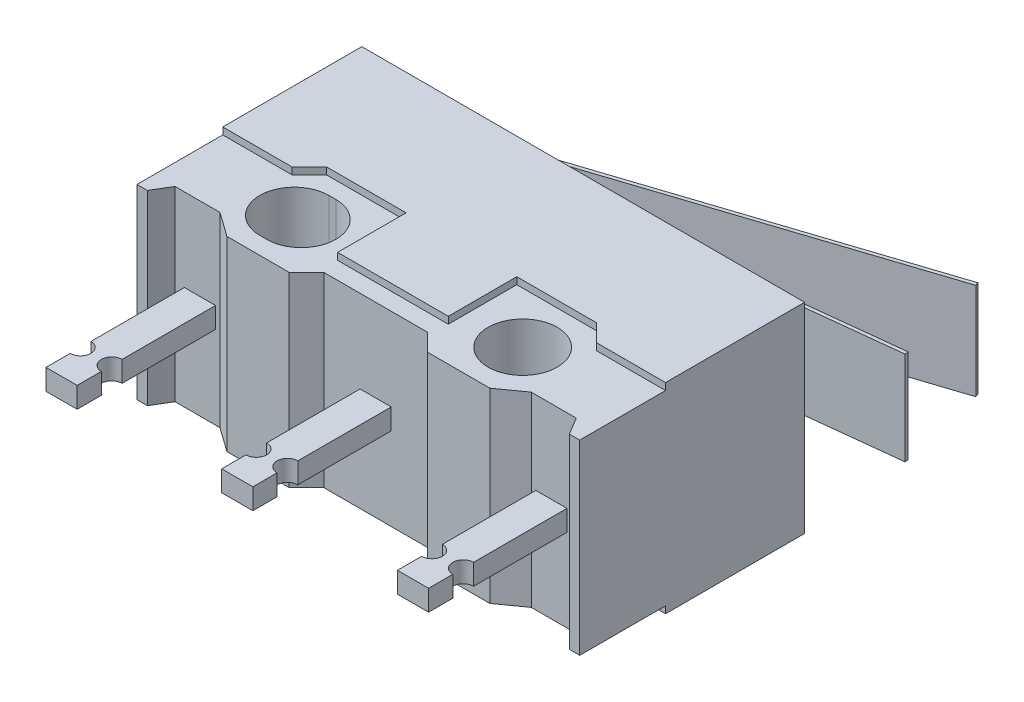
SolidWorks part; units mm, degrees
ref_plane "DESSUS" through (0, 0, 0) normal (0, 0, 1) x (1, 0, 0)
ref_plane "FACE" through (0, 0, 0) normal (0, 1, 0) x (1, 0, 0)
ref_plane "COTE" through (0, 0, 0) normal (1, 0, 0) x (0, 0, -1)
sketch "Esquisse1" plane through (0, 0, 0) normal (0, 1, 0) x (1, 0, 0)
  line L0 (-6.4, 3.25) -> (6.4, -3.25) construction
  line L1 (-6.4, 3.25) -> (6.4, 3.25)
  line L2 (-6.4, 3.25) -> (-6.4, -3.25)
  line L3 (-6.4, -3.25) -> (-6.1, -3.25)
  line L4 (6.4, 3.25) -> (6.4, -3.25)
  line L5 (-3.35, -0.75) -> (-3.15, -0.75)
  line L6 (-3.35, -2.75) -> (-3.15, -2.75)
  line L7 (-3.25, -0.75) -> (-3.25, -2.75) construction
  line L8 (-6.1, -3.25) -> (-5.8, -2.75)
  line L9 (-5.8, -2.75) -> (-4.5, -2.75)
  line L10 (-4.5, -2.75) -> (-3.8, -3.25)
  line L11 (-3.8, -3.25) -> (-2, -3.25)
  line L12 (-2, -3.25) -> (-1.5, -2.75)
  line L13 (-1.5, -2.75) -> (1.5, -2.75)
  line L14 (0, 4.8) -> (0, -4.8) construction
  line L15 (6.4, -3.25) -> (6.1, -3.25)
  line L16 (2, -3.25) -> (1.5, -2.75)
  line L17 (3.8, -3.25) -> (2, -3.25)
  line L18 (4.5, -2.75) -> (3.8, -3.25)
  line L19 (5.8, -2.75) -> (4.5, -2.75)
  line L20 (6.1, -3.25) -> (5.8, -2.75)
  arc A0 (-3.35, -0.75) -> (-3.35, -2.75) centre (-3.35, -1.75) ccw
  circle A1 centre (3.25, -1.75) radius 1
  arc A2 (-3.15, -2.75) -> (-3.15, -0.75) centre (-3.15, -1.75) ccw
  point P25 (0, -2.74)
  dimension "D2" = 2
  dimension "D3" = 2.2
  dimension "D5" = 1.5
  dimension "D7" = 3.25
  dimension "D1" = 12.8
  dimension "D4" = 5
  dimension "D6" = 6.5
  dimension "D8" = 0.3
  dimension "D10" = 0.3
  dimension "D11" = 1.3
  dimension "D12" = 0.7
  dimension "D13" = 0.5
  dimension "D14" = 0.5
  dimension "D15" = 1.8
extrude "Extrusion1" add sketch "Esquisse1" along normal mid plane 5.79
sketch "Esquisse2" plane through (0, 2.895, 0) normal (0, 1, 0) x (-1, 0, 0)
  line L0 (6.4, 0.77) -> (4.4, 0.77)
  line L1 (4.4, 0.77) -> (3.9, 0.27)
  line L2 (3.9, 0.27) -> (1.6, 0.27)
  line L3 (1.6, 0.27) -> (1.6, 2.25)
  line L4 (1.6, 2.25) -> (-1.6, 2.25)
  line L5 (6.4, 0.77) -> (6.4, 3.25)
  line L6 (0, -4.1) -> (0, 4.7) construction
  line L7 (-6.1, 3.25) -> (-6.4, 3.25) construction
  line L8 (-5.8, 2.75) -> (-6.1, 3.25) construction
  line L9 (-4.5, 2.75) -> (-5.8, 2.75) construction
  line L10 (-3.8, 3.25) -> (-4.5, 2.75) construction
  line L11 (-2, 3.25) -> (-3.8, 3.25) construction
  line L12 (-1.5, 2.75) -> (-2, 3.25) construction
  line L13 (1.5, 2.75) -> (-1.5, 2.75) construction
  line L14 (2, 3.25) -> (1.5, 2.75) construction
  line L15 (3.8, 3.25) -> (2, 3.25) construction
  line L16 (4.5, 2.75) -> (3.8, 3.25) construction
  line L17 (5.8, 2.75) -> (4.5, 2.75) construction
  line L18 (6.1, 3.25) -> (5.8, 2.75) construction
  line L19 (6.4, 3.25) -> (6.1, 3.25) construction
  line L20 (-6.1, 3.25) -> (-6.4, 3.25)
  line L21 (-5.8, 2.75) -> (-6.1, 3.25)
  line L22 (-4.5, 2.75) -> (-5.8, 2.75)
  line L23 (-3.8, 3.25) -> (-4.5, 2.75)
  line L24 (-2, 3.25) -> (-3.8, 3.25)
  line L25 (-1.5, 2.75) -> (-2, 3.25)
  line L26 (1.5, 2.75) -> (-1.5, 2.75)
  line L27 (2, 3.25) -> (1.5, 2.75)
  line L28 (3.8, 3.25) -> (2, 3.25)
  line L29 (4.5, 2.75) -> (3.8, 3.25)
  line L30 (5.8, 2.75) -> (4.5, 2.75)
  line L31 (6.1, 3.25) -> (5.8, 2.75)
  line L32 (6.4, 3.25) -> (6.1, 3.25)
  line L33 (-6.4, 3.25) -> (-6.4, 0.77)
  line L34 (-3.9, 0.27) -> (-1.6, 0.27)
  line L35 (-4.4, 0.77) -> (-3.9, 0.27)
  line L36 (-6.4, 0.77) -> (-4.4, 0.77)
  line L37 (-1.6, 0.27) -> (-1.6, 2.25)
  point P30 (0, 2.25)
  dimension "D1" = 2
  dimension "D2" = 0.5
  dimension "D3" = 0.5
  dimension "D4" = 1.98
  dimension "D5" = 4.8
  dimension "D6" = 0.5
extrude "Enlèv. mat.-Extru.1" cut sketch "Esquisse2" against normal blind 0.2
mirror "Symétrie1" about plane through (0, 0, 0) normal (0, 1, 0) of "Enlèv. mat.-Extru.1"
sketch "Esquisse3" plane through (0, 0, 0) normal (0, 1, 0) x (1, 0, 0)
  line L0 (-5.08, 4.6) -> (-5.08, -5.4) construction
  line L1 (-5.53, -2.75) -> (-5.53, -5.45)
  line L2 (-5.53, -2.75) -> (-4.63, -2.75)
  line L3 (-1.5, -2.75) -> (1.5, -2.75) construction
  line L4 (-5.53, -6.75) -> (-4.63, -6.75)
  line L5 (-5.53, -6.05) -> (-5.53, -6.75)
  line L6 (-4.63, -6.05) -> (-4.63, -6.75)
  line L7 (-4.63, -2.75) -> (-4.63, -5.45)
  line L8 (2, -3.25) -> (3.8, -3.25) construction
  line L9 (0, 4) -> (0, -4.7) construction
  arc A0 (-5.53, -6.05) -> (-5.53, -5.45) centre (-5.53, -5.75) ccw
  arc A1 (-4.63, -6.05) -> (-4.63, -5.45) centre (-4.63, -5.75) cw
  point P16 (-5.08, -6.75)
  point P17 (-5.08, -2.75)
  dimension "D3" = 1
  dimension "D4" = 0.3
  dimension "D1" = 0.9
  dimension "D2" = 3.5
  dimension "D5" = 5.08
extrude "Extrusion2" add sketch "Esquisse3" along normal mid plane 0.6
pattern_linear "Répétition linéaire1" count 3 spacing 5.08 along (1, 0, 0) of "Extrusion2"
sketch "Esquisse5" plane through (0, 0, 0) normal (0, 1, 0) x (1, 0, 0)
  line L0 (-5.2, 3.25) -> (-5.2, 3.45)
  line L1 (-4.9934, 3.7351) -> (6.95, 7.65)
  line L2 (6.4, 3.25) -> (-6.4, 3.25) construction
  line L3 (-6.4, 3.25) -> (-6.4, -0.77) construction
  circle A1 centre (3.25, -1.75) radius 1 construction
  arc A2 (-5.2, 3.45) -> (-4.9934, 3.7351) centre (-4.9, 3.45) cw
  dimension "D1" = 3.7
  dimension "D2" = 9.4
  dimension "D3" = 0.3
  dimension "D4" = 1.2
  dimension "D5" = 0.2
extrude "Extru.-Mince3" add sketch "Esquisse5" along normal mid plane 2.79 separate body thin
sketch "Esquisse6" plane through (0, 0, 0) normal (0, 1, 0) x (1, 0, 0)
  line L0 (-5.3, 3.25) -> (-5.2155, 3.4313)
  line L1 (-4.8972, 3.6599) -> (7.5944, 5.05)
  line L2 (-5.3, 3.25) -> (-5.3, 3.45) construction
  line L3 (-5.0246, 3.8301) -> (6.9189, 7.745) construction
  arc A0 (6.9189, 7.745) -> (7.5944, 5.05) centre (-5.3, 3.25) cw construction
  circle A1 centre (3.25, -1.75) radius 1 construction
  arc A2 (-4.8972, 3.6599) -> (-5.2155, 3.4313) centre (-4.853, 3.2623) ccw
  arc A3 (-5.0246, 3.8301) -> (-5.3, 3.45) centre (-4.9, 3.45) ccw construction
  dimension "D1" = 6.8
  dimension "D2" = 4.3444
extrude "Extru.-Mince4" add sketch "Esquisse6" along normal mid plane 2.7 separate body thin
sketch "Esquisse4" plane through (0, 0, 0) normal (0, 1, 0) x (1, 0, 0)
  line L0 (-2.29, 3.65) -> (-2.29, 2.4917) construction
  line L1 (-2.74, 3.25) -> (-1.84, 3.25)
  line L2 (-2.74, 3.25) -> (-2.74, 3.65)
  line L3 (-2.74, 3.65) -> (-1.84, 3.65)
  line L4 (-1.84, 3.25) -> (-1.84, 3.65)
  line L5 (6.4, 3.25) -> (-6.4, 3.25) construction
  circle A0 centre (3.25, -1.75) radius 1 construction
  dimension "D1" = 5.54
  dimension "D3" = 5.4
  dimension "D2" = 0.9
extrude "Extrusion3" add sketch "Esquisse4" along normal mid plane 2.8
fillet "Congé1" radius 0.1 4 edges at (-1.84, 0, -3.65) (-2.29, 1.4, -3.65) (-2.74, 0, -3.65) (-2.29, -1.4, -3.65)
fillet "Congé2" radius 0.4 8 edges at (-2.74, -1.4, -3.4) (-1.84, -1.4, -3.4) (-1.84, 1.4, -3.4) (-2.74, 1.4, -3.4) (-2.7107, -1.3707, -3.6207) (-1.8693, -1.3707, -3.6207) (-1.8693, 1.3707, -3.6207) (-2.7107, 1.3707, -3.6207)
